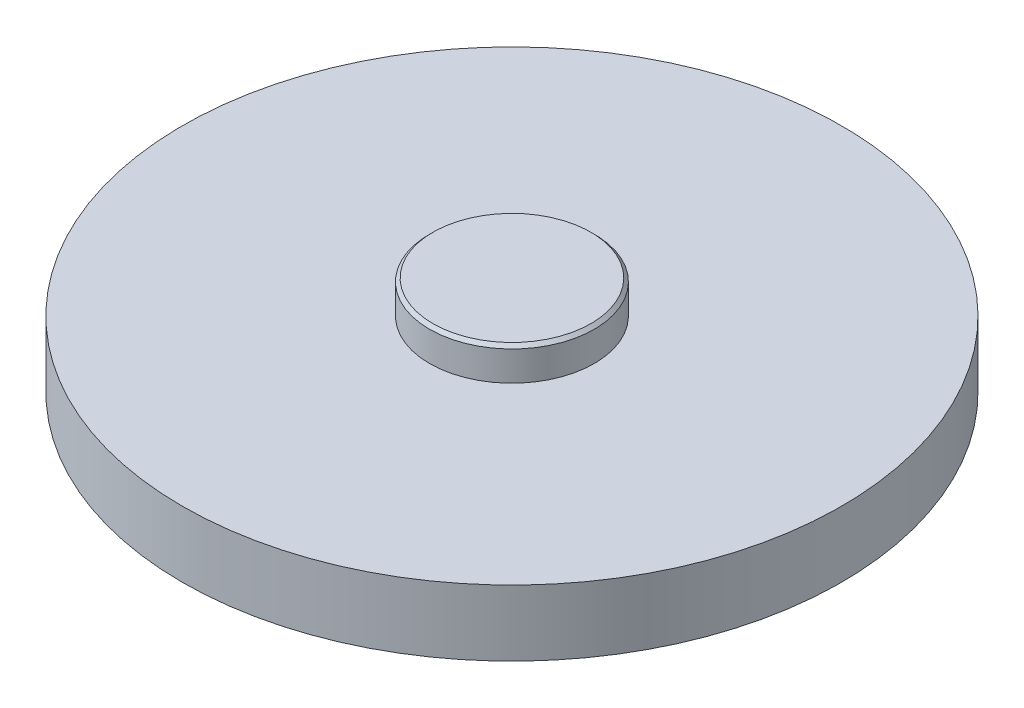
SolidWorks part; units mm, degrees
ref_plane "Plan de face" through (0, 0, 0) normal (0, 0, 1) x (1, 0, 0)
ref_plane "Plan de dessus" through (0, 0, 0) normal (0, 1, 0) x (1, 0, 0)
ref_plane "Plan de droite" through (0, 0, 0) normal (1, 0, 0) x (0, 0, -1)
sketch "Esquisse1" plane through (0, 0, 0) normal (0, 1, 0) x (1, 0, 0)
  circle A0 centre (0, 0) radius 100
  dimension "D1" = 200
extrude "Boss.-Extru.1" add sketch "Esquisse1" along normal blind 20
sketch "Esquisse2" plane through (0, 20, 0) normal (0, 1, 0) x (1, 0, 0)
  circle A0 centre (0, 0) radius 25
  dimension "D1" = 50
extrude "Boss.-Extru.2" add sketch "Esquisse2" along normal blind 10
chamfer "Chanfrein1" distance 1 angle 45 1 edges at (0, 30, 25)
sketch "Esquisse3" plane through (0, 0, 0) normal (0, -1, 0) x (1, 0, 0)
  line L1 (10, -20) -> (-10, -20)
  line L2 (10, -20) -> (10, 20)
  line L3 (10, 20) -> (-10, 20)
  line L4 (-10, -20) -> (-10, 20)
  line L5 (10, -20) -> (-10, 20) construction
  line L6 (10, 20) -> (-10, -20) construction
  point P0 (0, 0)
  dimension "D1" = 20
  dimension "D2" = 40
extrude "Boss.-Extru.3" add sketch "Esquisse3" along normal blind 20
chamfer "Chanfrein2" distance 1 angle 45 4 edges at (0, -20, 20) (10, -20, 0) (0, -20, -20) (-10, -20, 0)
